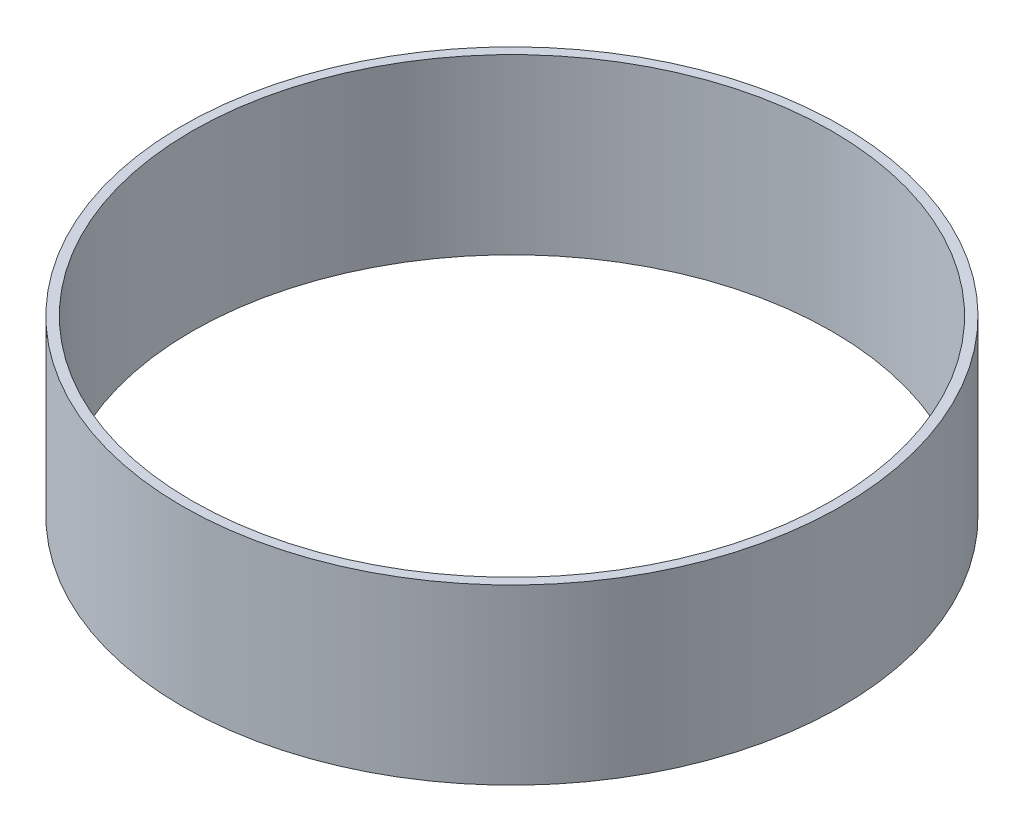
SolidWorks part; units mm, degrees
ref_plane "Front Plane" through (0, 0, 0) normal (0, 0, 1) x (1, 0, 0)
ref_plane "Top Plane" through (0, 0, 0) normal (0, 1, 0) x (1, 0, 0)
ref_plane "Right Plane" through (0, 0, 0) normal (1, 0, 0) x (0, 0, -1)
sketch "Sketch2" plane through (0, 0, 0) normal (0, 1, 0) x (1, 0, 0)
  circle A0 centre (0, 0) radius 33
  circle A1 centre (0, 0) radius 32.05
extrude "Boss-Extrude2" add sketch "Sketch2" along normal blind 17.36
